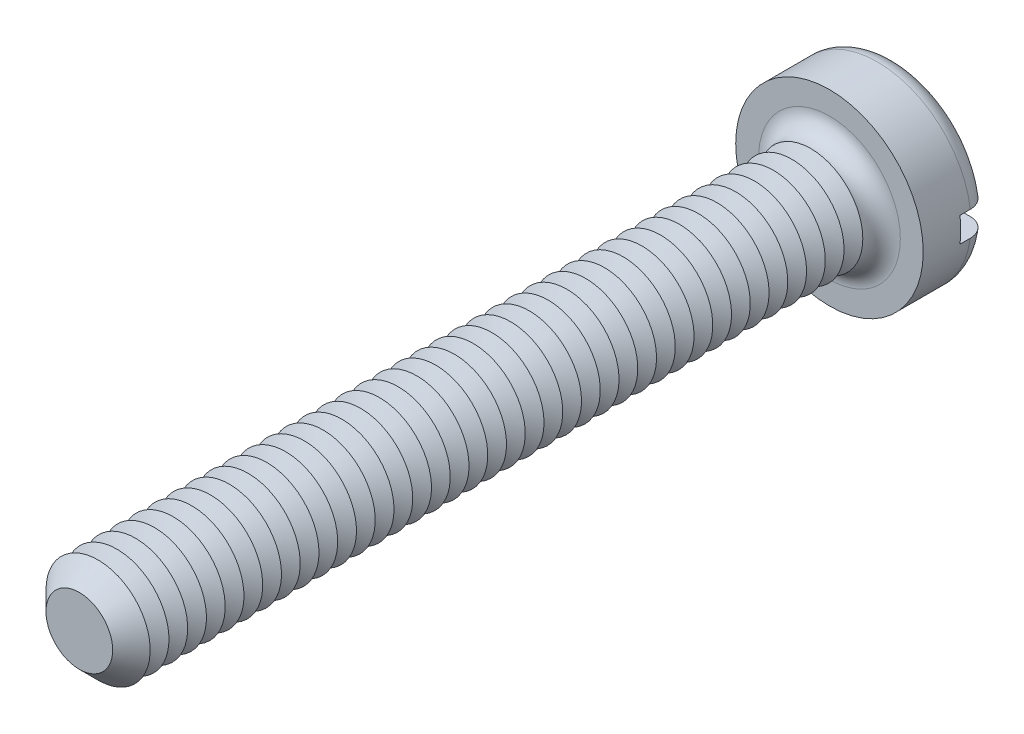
SolidWorks part; units mm, degrees
ref_plane "Front Plane" through (0, 0, 0) normal (0, 0, 1) x (1, 0, 0)
ref_plane "Top Plane" through (0, 0, 0) normal (0, 1, 0) x (1, 0, 0)
ref_plane "Right Plane" through (0, 0, 0) normal (1, 0, 0) x (0, 0, -1)
sketch "Sketch3" plane through (0, 0, 0) normal (0, 0, 1) x (1, 0, 0)
  circle A0 centre (0, 0) radius 2.25
  dimension "D1" = 4.5
extrude "Boss-Extrude2" add sketch "Sketch3" against normal blind 1.6
sketch "Sketch4" plane through (0, 0, 0) normal (0, 0, 1) x (1, 0, 0)
  circle A0 centre (0, 0) radius 1.25
  dimension "D1" = 2.5
extrude "Boss-Extrude3" add sketch "Sketch4" along normal blind 18
fillet "Fillet1" radius 0.45 2 edges at (2.25, 0, -1.6) (1.25, 0, 0)
chamfer "Chamfer1" distance 0.45 angle 45 1 edges at (1.25, 0, 18)
sketch "Sketch5" plane through (0, 0, 0) normal (1, 0, 0) x (0, 0, -1)
  line L0 (1.6944, 0) -> (-7.6738, 0) construction
sketch "Sketch6" plane through (0, 0, 0) normal (1, 0, 0) x (0, 0, -1)
  line L0 (-0.45, 1.25) -> (-0.675, 0.8603)
  line L1 (-0.675, 0.8603) -> (-0.9, 1.25)
  line L2 (-0.45, 1.25) -> (-17.55, 1.25) construction
  line L3 (-0.9, 1.25) -> (-0.45, 1.25)
  dimension "D1" = 0.45
revolve "Cut-Revolve1" cut sketch "Sketch6" angle 360 about L0
pattern_linear "LPattern1" count 38 spacing 0.45 along (0, 0, 1) of "Cut-Revolve1"
sketch "Sketch8" plane through (0, 0, -1.6) normal (0, 0, -1) x (-1, 0, 0)
  line L1 (2.25, -0.3) -> (-2.25, -0.3)
  line L2 (2.25, -0.3) -> (2.25, 0.3)
  line L3 (2.25, 0.3) -> (-2.25, 0.3)
  line L4 (-2.25, -0.3) -> (-2.25, 0.3)
  line L5 (2.25, -0.3) -> (-2.25, 0.3) construction
  line L6 (2.25, 0.3) -> (-2.25, -0.3) construction
  point P0 (0, 0)
  dimension "D1" = 4.5
  dimension "D2" = 0.6
extrude "Cut-Extrude1" cut sketch "Sketch8" against normal blind 0.7
